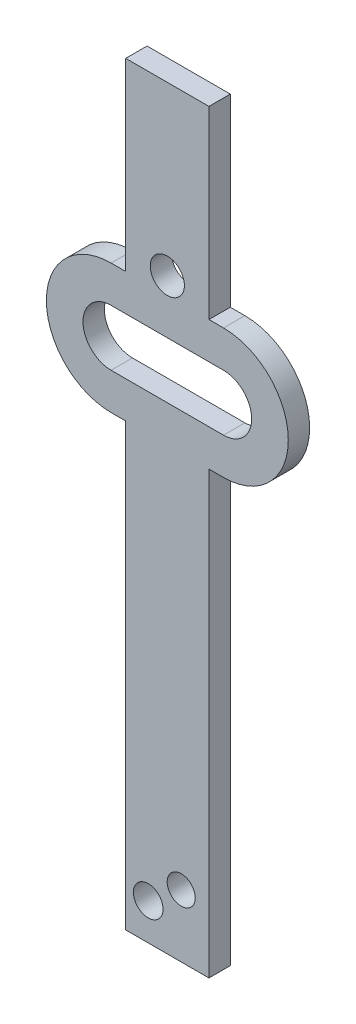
SolidWorks part; units mm, degrees
ref_plane "Front Plane" through (0, 0, 0) normal (0, 0, 1) x (1, 0, 0)
ref_plane "Top Plane" through (0, 0, 0) normal (0, 1, 0) x (1, 0, 0)
ref_plane "Right Plane" through (0, 0, 0) normal (1, 0, 0) x (0, 0, -1)
sketch "Sketch1" plane through (0, 0, 0) normal (0, 0, 1) x (1, 0, 0)
  line L0 (5.85, -53.045) -> (5.85, -6.045)
  line L1 (-5.85, -53.045) -> (5.85, -53.045)
  line L2 (-5.85, -53.045) -> (-5.85, 53.045)
  line L3 (-5.85, 53.045) -> (5.85, 53.045)
  line L4 (5.85, -53.045) -> (5.85, 53.045)
  line L5 (-5.85, -53.045) -> (5.85, 53.045) construction
  line L6 (-5.85, 53.045) -> (5.85, -53.045) construction
  line L7 (0, 0) -> (0, 8.9014)
  line L8 (-7.9, 8.9014) -> (7.9, 8.9014)
  line L9 (0, 8.9014) -> (0, 27.1014)
  line L10 (-7.9, 27.1014) -> (7.9, 27.1014)
  line L11 (7.9, 27.1014) -> (-1.2, 27.1014)
  line L12 (-7.9, 21.9514) -> (7.9, 21.9514)
  line L13 (7.9, 14.0514) -> (-7.9, 14.0514)
  line L14 (0, 27.1014) -> (0, 29.5014)
  line L15 (-5.85, -53.045) -> (-2.685, -53.045)
  line L16 (-2.685, -53.045) -> (-2.685, -47.91)
  arc A1 (7.9, 27.1014) -> (7.9, 8.9014) centre (7.9, 18.0014) cw
  arc A2 (-7.9, 27.1014) -> (-7.9, 8.9014) centre (-7.9, 18.0014) ccw
  arc A3 (-7.9, 21.9514) -> (-7.9, 14.0514) centre (-7.9, 18.0014) ccw
  arc A4 (7.9, 21.9514) -> (7.9, 14.0514) centre (7.9, 18.0014) cw
  circle A6 centre (0, 29.5014) radius 2.4
  circle A7 centre (-2.685, -47.91) radius 2.085
  circle A8 centre (1.9536, -44.2714) radius 1.975
  point P0 (0, 0)
  point P10 (0, 0)
  point P13 (0, 8.9014)
  point P17 (0, 27.1014)
  dimension "D8" = 2.4
  dimension "D1" = 106.09
  dimension "D2" = 11.7
  dimension "D3" = 47
  dimension "D4" = 15.8
  dimension "D5" = 18.2
  dimension "D6" = 15.8
  dimension "D7" = 9.1
  dimension "D9" = 3.165
  dimension "D10" = 5.135
extrude "Boss-Extrude1" add sketch "Sketch1" along normal blind 3
sketch "Sketch2" plane through (0, 0, 0) normal (0, 0, -1) x (-1, 0, 0)
  line L5 (5.85, -53.045) -> (-5.85, -53.045) construction
  line L6 (-1.2045, -53.045) -> (-1.2045, -50.995)
  line L7 (-1.2045, -50.995) -> (1.2955, -50.995)
  line L8 (1.2955, -50.995) -> (1.2955, -53.045)
  line L13 (-1.2045, -53.045) -> (1.2955, -53.045)
  dimension "D1" = 2.05
  dimension "D2" = 2.5
extrude "Cut-Extrude1" cut sketch "Sketch2" against normal blind 0.49
